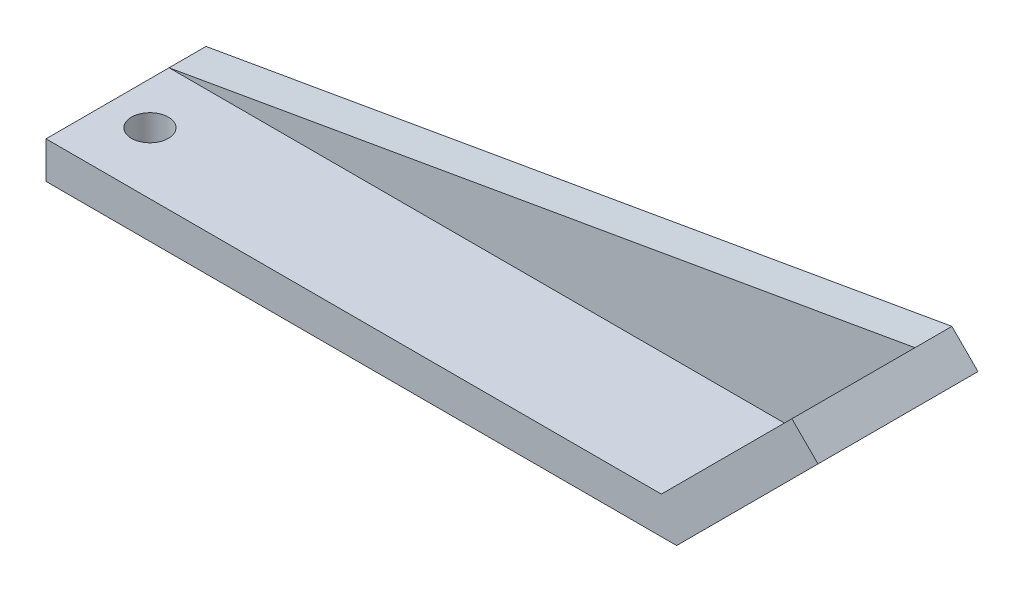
SolidWorks part; units mm, degrees
ref_plane "前视基准面" through (0, 0, 0) normal (0, 0, 1) x (1, 0, 0)
ref_plane "上视基准面" through (0, 0, 0) normal (0, 1, 0) x (1, 0, 0)
ref_plane "右视基准面" through (0, 0, 0) normal (1, 0, 0) x (0, 0, -1)
sketch "草图1" plane through (0, 0, 0) normal (0, 0, 1) x (1, 0, 0)
  line L0 (0, 0) -> (10.6066, 10.6066)
  line L1 (0, 0) -> (-50, 0)
  line L2 (10.6066, 10.6066) -> (12.7279, 8.4853)
  line L3 (12.7279, 8.4853) -> (1.2426, -3)
  line L4 (-50, 0) -> (-50, -3)
  line L5 (-50, -3) -> (1.2426, -3)
  dimension "D1" = 135
  dimension "D2" = 15
  dimension "D3" = 3
  dimension "D4" = 3
  dimension "D5" = 50
extrude "凸台-拉伸1" add sketch "草图1" along normal blind 10
sketch "草图3" plane through (0, 0, 0) normal (0, 0, -1) x (-1, 0, 0)
  line L0 (-10.6066, 10.6066) -> (50, 0)
  line L1 (50, 0) -> (50, -3)
  line L2 (50, -3) -> (-1.2426, -3)
  line L3 (-1.2426, -3) -> (-12.7279, 8.4853)
  line L4 (-12.7279, 8.4853) -> (-10.6066, 10.6066)
extrude "凸台-拉伸2" add sketch "草图3" along normal blind 3
sketch "草图4" plane through (0, 0, 0) normal (-0.7071, 0.7071, 0) x (0, 0, 1)
  line L0 (10, 15) -> (0, 15) construction
  line L1 (10, 15) -> (10, 0) construction
  circle A0 centre (4.6, 7.8285) radius 1.5
  dimension "D1" = 7.1715
  dimension "D2" = 5.4
extrude "切除-拉伸2" cut sketch "草图4" against normal blind 3
sketch "草图5" plane through (0, 0, 0) normal (0, 1, 0) x (1, 0, 0)
  line L0 (-50, -10) -> (-50, 0) construction
  circle A0 centre (-46.5574, -5) radius 1.5
  dimension "D1" = 3.4426
extrude "切除-拉伸3" cut sketch "草图5" against normal blind 30
